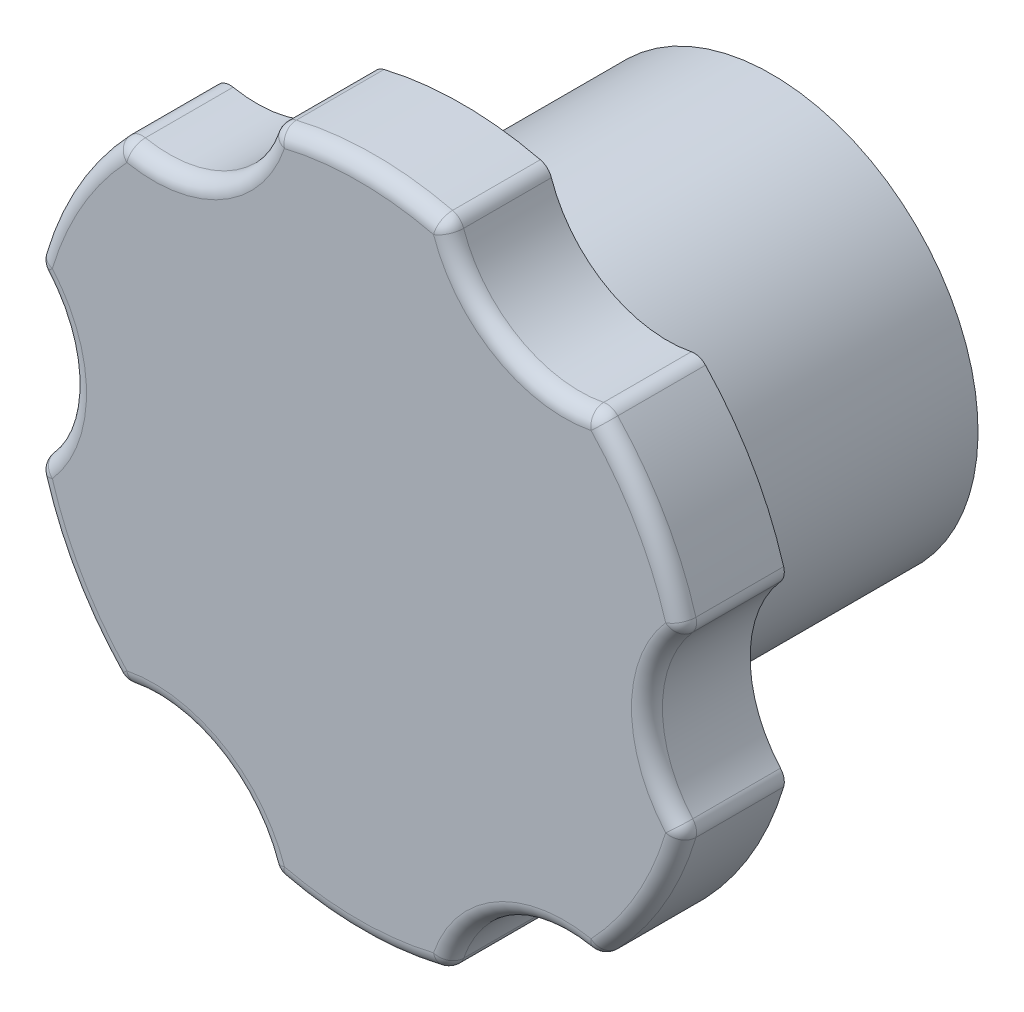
SolidWorks part; units mm, degrees
other "<Emergency Valve Knob>-<Shell1>"
ref_plane "Front Plane" through (0, 0, 0) normal (0, 0, 1) x (1, 0, 0)
ref_plane "Top Plane" through (0, 0, 0) normal (0, 1, 0) x (1, 0, 0)
ref_plane "Right Plane" through (0, 0, 0) normal (1, 0, 0) x (0, 0, -1)
mirrored part "Emergency Valve Knob_Mirrored"
